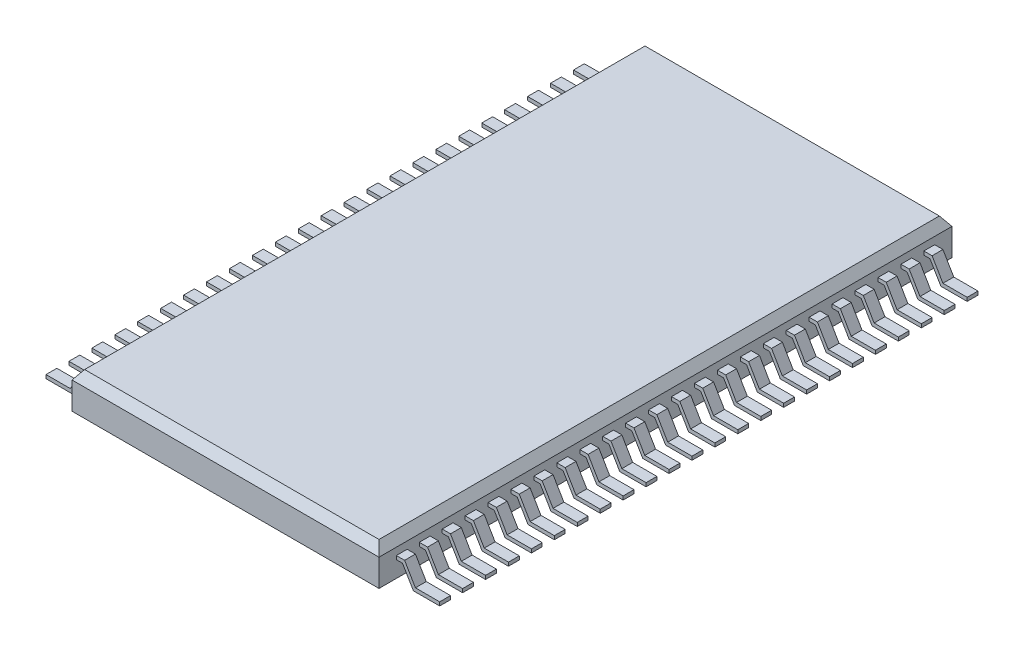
SolidWorks part; units mm, degrees
ref_plane "Front Plane" through (0, 0, 0) normal (0, 0, 1) x (1, 0, 0)
ref_plane "Top Plane" through (0, 0, 0) normal (0, 1, 0) x (1, 0, 0)
ref_plane "Right Plane" through (0, 0, 0) normal (1, 0, 0) x (0, 0, -1)
sketch "Sketch1" plane through (0, 0, 0) normal (0, 1, 0) x (1, 0, 0)
  line L0 (0, 6.8835) -> (0, -6.8835) construction
  line L1 (-5.5575, 0) -> (5.5575, 0) construction
  line L3 (-4.25, 8.25) -> (4.25, 8.25)
  line L4 (-4.25, 8.25) -> (-4.25, -8.25)
  line L5 (-4.25, -8.25) -> (4.25, -8.25)
  line L6 (4.25, 8.25) -> (4.25, -8.25)
  dimension "D1" = 8.5
  dimension "D2" = 16.5
extrude "Extrude1" add sketch "Sketch1" along normal mid plane 1
chamfer "Chamfer1" distance 0.25 angle 35 4 edges at (0, 0.5, -8.25) (4.25, 0.5, 0) (0, 0.5, 8.25) (-4.25, 0.5, 0)
sketch "Sketch4" plane through (0, 0, 0) normal (0, 0, 1) x (1, 0, 0)
  line L0 (0, 1.2724) -> (0, -0.9364) construction
  line L1 (-4.25, 1.8525) -> (-4.25, -1.3157) construction
  line L2 (-4.25, 0.25) -> (-4.25, -0.5) construction
  line L3 (0, 0) -> (-6.2695, 0) construction
  line L4 (-5.45, 1.2724) -> (-5.45, -1.1019) construction
  line L5 (-4.25, 0) -> (-4.45, 0)
  line L6 (-4.45, 0) -> (-4.75, -0.51)
  line L7 (-4.75, -0.51) -> (-5.45, -0.51)
  line L9 (-4.25, -0.5) -> (4.25, -0.5) construction
  point P19 (-4.45, 0)
  point P22 (-4.75, -0.51)
  dimension "D1" = 1.2
  dimension "D2" = 0.01
  dimension "D3" = 0.7
  dimension "D4" = 0.2
extrude "Extrude-Thin1" add sketch "Sketch4" along normal mid plane 0.3 thin
pattern_linear "LPattern1" count 13 spacing 0.635 along (0, 0, -1) count 12 spacing 0.635 along (0, 0, 1) of "Extrude-Thin1"
mirror "Mirror1" about plane through (0, 0, 0) normal (1, 0, 0) of "LPattern1", "Extrude-Thin1"
other "Move Face1" parameters "D1"=0.635
